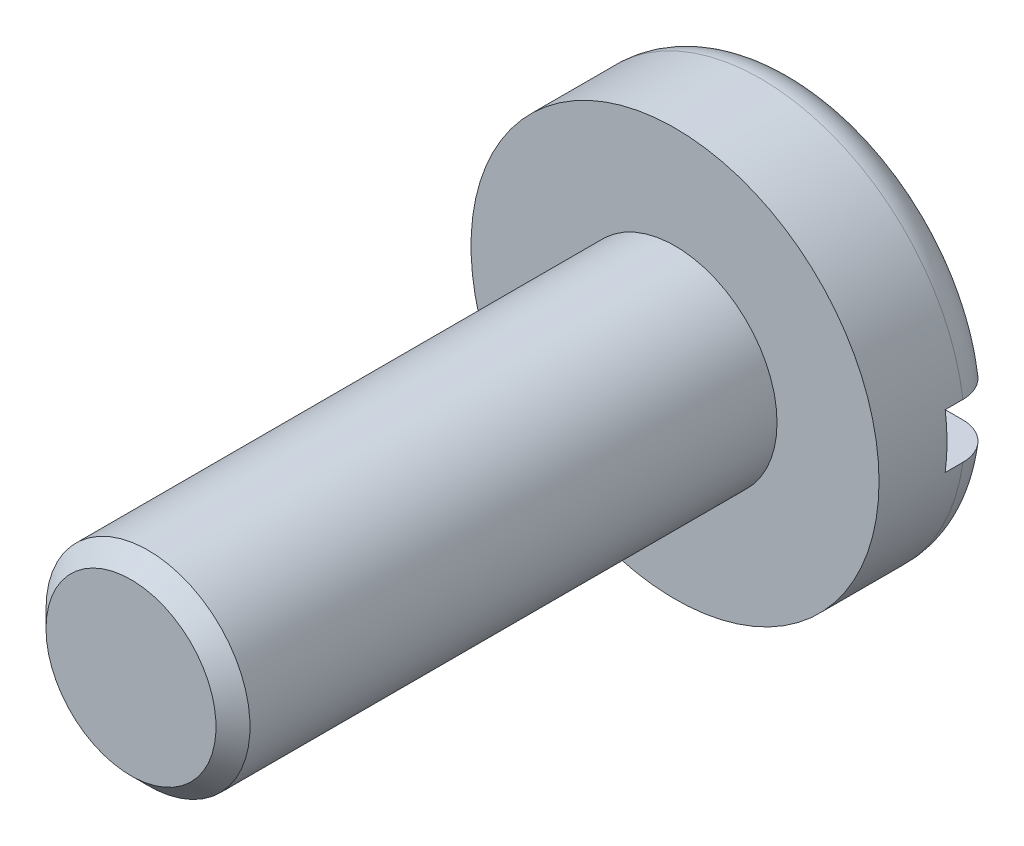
SolidWorks part; units mm, degrees
ref_plane "Plan1" through (0, 0, 0) normal (0, 0, 1) x (1, 0, 0)
ref_plane "Plan2" through (0, 0, 0) normal (0, 1, 0) x (1, 0, 0)
ref_plane "Plan3" through (0, 0, 0) normal (1, 0, 0) x (0, 0, -1)
sketch "profil tête" plane through (0, 0, 0) normal (0, 0, 1) x (1, 0, 0)
  circle A0 centre (0, 0) radius 6
  dimension "DIAMETRE" = 12
extrude "TETE" add sketch "profil tête" along normal blind 3.6
fillet "CONGE" radius 1.08 1 edges at (6, 0, 0)
sketch "profil fente" plane through (0, 0, 0) normal (1, 0, 0) x (0, 0, -1)
  line L0 (0, -6) -> (0, 6) construction
  line L1 (-1.6, 0.8) -> (0, 0.8)
  line L2 (-1.6, 0.8) -> (-1.6, -0.8)
  line L3 (-1.6, -0.8) -> (0, -0.8)
  line L4 (0, 0.8) -> (0, -0.8)
  dimension "LARGEUR" = 1.6
extrude "FENTE" cut sketch "profil fente" against normal through all and the other way through all
sketch "profil cylindre" plane through (0, 0, 3.6) normal (0, 0, 1) x (1, 0, 0)
  circle A0 centre (0, 0) radius 3
  dimension "DIAMETRE" = 6
extrude "CYLINDRE FILETE" add sketch "profil cylindre" along normal blind 16
revolve "CHANFREIN FILET" cut sketch "profil chanfrein" angle 360 about L4
sketch "profil chanfrein" plane through (0, 0, 0) normal (1, 0, 0) x (0, 0, -1)
  line L0 (-19.6, 2.5) -> (-19.1, 3)
  line L1 (-19.6, 3) -> (-19.6, -3) construction
  line L2 (-19.6, 3) -> (-19.1, 3)
  line L3 (-3.6, 3) -> (-19.6, 3) construction
  line L4 (-12.0874, 0) -> (-18.1046, 0) construction
  line L5 (-19.6, 0) -> (-3.6, 0) construction
  line L8 (-19.6, 3) -> (-19.6, 2.5)
  dimension "D2" = 5
  dimension "D3" = 45
equation "\"D2@profil chanfrein\" = \"DIAMETRE FOND FILET@Représentation de filetage1\""
equation "\"RAYON@CONGE\"=\"HAUTEUR@TETE\"*0.3"
